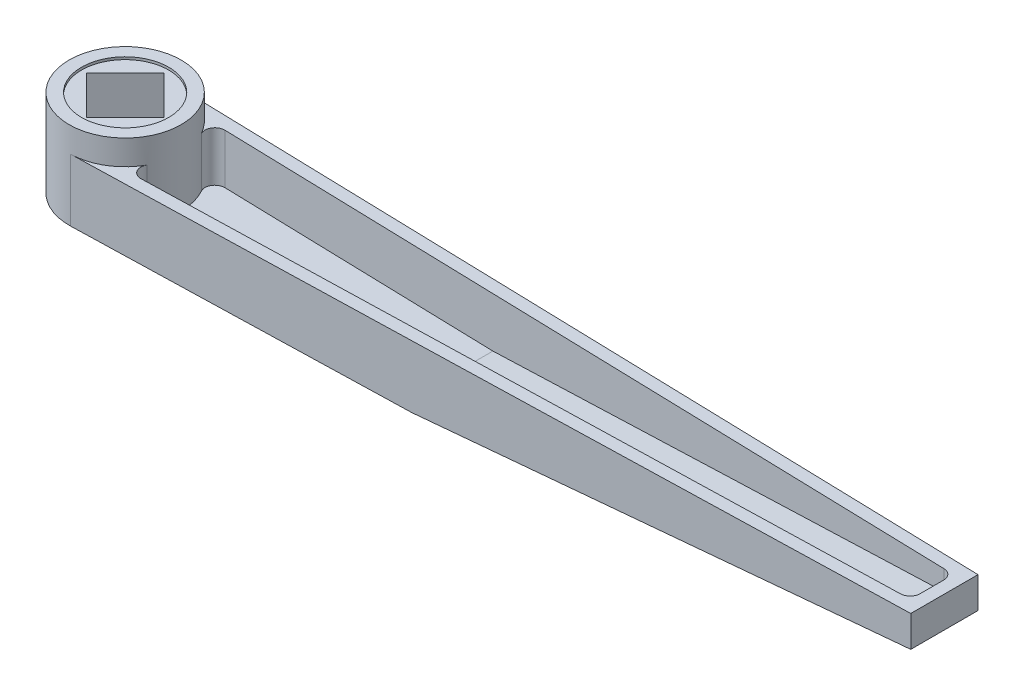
SolidWorks part; units mm, degrees
ref_plane "XY" through (0, 0, 0) normal (0, 0, 1) x (1, 0, 0)
ref_plane "XZ" through (0, 0, 0) normal (0, 1, 0) x (1, 0, 0)
ref_plane "YZ" through (0, 0, 0) normal (1, 0, 0) x (0, 0, -1)
sketch "A" plane through (0, 0, 0) normal (0, 1, 0) x (1, 0, 0)
  line L0 (0, 0) -> (329, 0) construction
  line L1 (0.6158, 22.4916) -> (329, 13.5)
  line L2 (329, 13.5) -> (329, -13.5)
  line L3 (0.6158, -22.4916) -> (329, -13.5)
  line L4 (0.6158, 22.4916) -> (0.6158, -22.4916)
  circle A0 centre (0, 0) radius 22.5
  dimension "D1" = 45
  dimension "D2" = 27
  dimension "D3" = 329
extrude "X1" add sketch "A" along normal blind 25 contours L0 A0 L3 L2 | A0 L0 L2 L1
sketch "B" plane through (0, 0, 0) normal (0, 0, 1) x (1, 0, 0)
  line L0 (329, 12.5) -> (134, 0)
  line L1 (329, 25) -> (329, 0) construction
  line L2 (0.6158, 0) -> (329, 0) construction
  line L3 (134, 0) -> (134, -74.1467)
  line L4 (134, -74.1467) -> (362.4662, -74.1467)
  line L5 (362.4662, -74.1467) -> (356.9119, 12.5)
  line L6 (356.9119, 12.5) -> (329, 12.5)
  dimension "D1" = 195
extrude "X2" cut sketch "B" against normal through all and the other way through all
shell "S1" thickness 5
sketch "C" plane through (0, 0, 0) normal (0, 1, 0) x (1, 0, 0)
  circle A0 centre (0, 0) radius 22.5 construction
  circle A1 centre (0, 0) radius 22.5
extrude "X3" add sketch "C" along normal blind 35
sketch "D" plane through (0, 35, 0) normal (0, 1, 0) x (1, 0, 0)
  circle A0 centre (0, 0) radius 17.5
  dimension "D1" = 35
extrude "X5" cut sketch "D" against normal blind 1
sketch "E" plane through (0, 0, 0) normal (0, -1, 0) x (1, 0, 0)
  circle A1 centre (0, 0) radius 17.5
  dimension "D1" = 35
extrude "X6" cut sketch "E" against normal blind 1
sketch "F" plane through (0, 1, 0) normal (0, 1, 0) x (1, 0, 0)
  line L1 (0, 15.5563) -> (-15.5563, 0)
  line L2 (0, 15.5563) -> (15.5563, 0)
  line L3 (15.5563, 0) -> (0, -15.5563)
  line L4 (-15.5563, 0) -> (0, -15.5563)
  line L5 (0, 15.5563) -> (0, -15.5563) construction
  line L6 (15.5563, 0) -> (-15.5563, 0) construction
  point P0 (0, 0)
  dimension "D1" = 22
  dimension "D2" = 22
extrude "X7" cut sketch "F" along normal through all
fillet "F1" radius 4 4 edges at (324, 21.0949, 8.635) (324, 21.0949, -8.635) (14.6158, 15, -17.1064) (14.6158, 15, 17.1064)
